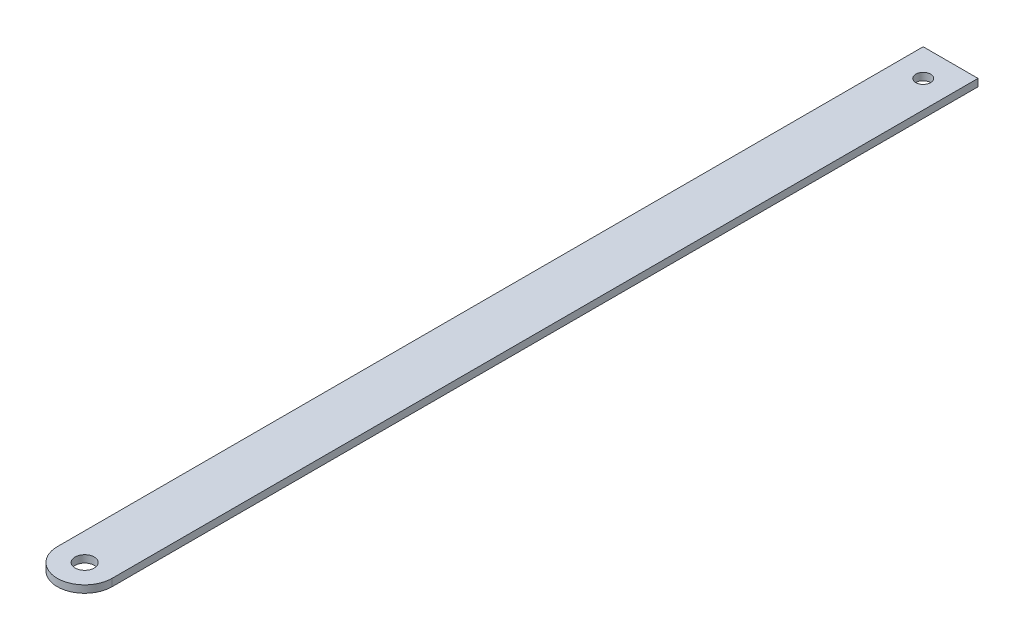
SolidWorks part; units mm, degrees
other "<Rotaladef07>-<Estrusione-Estrusione1>"
ref_plane "Piano frontale" through (0, 0, 0) normal (0, 0, 1) x (1, 0, 0)
ref_plane "Piano superiore" through (0, 0, 0) normal (0, 1, 0) x (1, 0, 0)
ref_plane "Piano destro" through (0, 0, 0) normal (1, 0, 0) x (0, 0, -1)
mirrored part "Rotaladef07_Specchiato"
